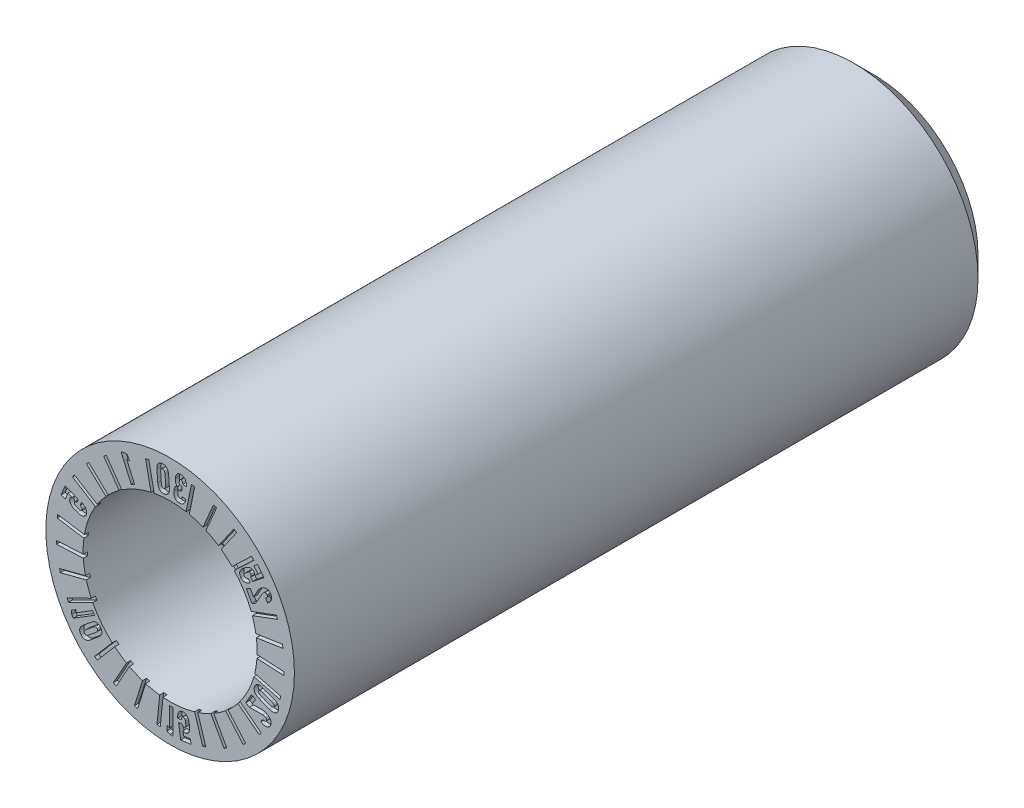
SolidWorks part; units mm, degrees
ref_plane "Front Plane" through (0, 0, 0) normal (0, 0, 1) x (1, 0, 0)
ref_plane "Top Plane" through (0, 0, 0) normal (0, 1, 0) x (1, 0, 0)
ref_plane "Right Plane" through (0, 0, 0) normal (1, 0, 0) x (0, 0, -1)
sketch "Sketch1" plane through (0, 0, 0) normal (1, 0, 0) x (0, 0, -1)
  line L0 (0, 0) -> (18.1572, 0) construction
  line L2 (17, 1.5) -> (17, 2.5)
  line L4 (16.5, 3) -> (0, 3)
  line L5 (0, 3) -> (0, 2.1)
  line L7 (0, 2.1) -> (3, 2.1)
  line L8 (3, 2.1) -> (3, 0.8)
  line L9 (3, 0.8) -> (12, 0.8)
  line L10 (17, 1.5) -> (12, 1.5)
  line L11 (12, 0.8) -> (12, 1.5)
  line L12 (17, 2.5) -> (16.5, 3)
  point P6 (17, 3)
  dimension "D1" = 17
  dimension "D2" = 6
  dimension "D3" = 4.2
  dimension "D4" = 3
  dimension "D5" = 1.6
  dimension "D6" = 3
  dimension "D7" = 5
revolve "Revolve1" add sketch "Sketch1" angle 360 about L0
sketch "Sketch2" plane through (0, 0, 0) normal (0, 0, 1) x (1, 0, 0)
  line L0 (0, 0) -> (0, 3.2841) construction
  line L1 (0, 0) -> (0.6611, 3.2169) construction
  line L2 (0, 0) -> (1.2951, 3.018) construction
  line L3 (0, 0) -> (1.8761, 2.6955) construction
  line L4 (0, 0) -> (2.3803, 2.2626) construction
  line L5 (0, 0) -> (2.787, 1.7372) construction
  line L6 (0, 0) -> (3.0797, 1.1406) construction
  line L7 (0, 0) -> (3.2462, 0.4973) construction
  line L8 (0, 0) -> (3.2799, -0.1663) construction
  line L9 (0, 0) -> (3.1793, -0.8232) construction
  line L10 (0, 0) -> (2.9485, -1.4463) construction
  line L11 (0, 0) -> (2.597, -2.0102) construction
  line L12 (0, 0) -> (2.1392, -2.4918) construction
  line L13 (0, 0) -> (1.5938, -2.8715) construction
  line L14 (0, 0) -> (0.9831, -3.1335) construction
  line L15 (0, 0) -> (0.3322, -3.2673) construction
  line L16 (0, 0) -> (-0.3322, -3.2673) construction
  line L17 (0, 0) -> (-0.9831, -3.1335) construction
  line L18 (0, 0) -> (-1.5938, -2.8715) construction
  line L19 (0, 0) -> (-2.1392, -2.4918) construction
  line L20 (0, 0) -> (-2.597, -2.0102) construction
  line L21 (0, 0) -> (-2.9485, -1.4463) construction
  line L22 (0, 0) -> (-3.1793, -0.8232) construction
  line L23 (0, 0) -> (-3.2799, -0.1663) construction
  line L24 (0, 0) -> (-3.2462, 0.4973) construction
  line L25 (0, 0) -> (-3.0797, 1.1406) construction
  line L26 (0, 0) -> (-2.787, 1.7372) construction
  line L27 (0, 0) -> (-2.3803, 2.2626) construction
  line L28 (0, 0) -> (-1.8761, 2.6955) construction
  line L29 (0, 0) -> (-1.2951, 3.018) construction
  line L30 (0, 0) -> (-0.6611, 3.2169) construction
  line L31 (0.5928, 2.6857) -> (0.4418, 1.951)
  line L32 (2.0637, 0.9899) -> (2.2207, 1.2619)
  line L33 (2.2731, 1.3172) -> (2.2736, 1.3176)
  line L34 (2.3047, 1.2213) -> (2.3044, 1.221)
  line L35 (2.3044, 1.221) -> (2.3485, 1.1416)
  line L36 (0.5144, 2.7018) -> (0.5928, 2.6857)
  line L37 (0.5144, 2.7018) -> (0.3634, 1.9671)
  line L38 (0.3634, 1.9671) -> (0.4418, 1.951)
  line L39 (1.1212, 2.5114) -> (0.8255, 1.8221)
  line L40 (1.0477, 2.5429) -> (1.1212, 2.5114)
  line L41 (1.0477, 2.5429) -> (0.752, 1.8537)
  line L42 (0.752, 1.8537) -> (0.8255, 1.8221)
  line L43 (1.6038, 2.2342) -> (1.1754, 1.6187)
  line L44 (1.5382, 2.28) -> (1.6038, 2.2342)
  line L45 (1.5382, 2.28) -> (1.1097, 1.6644)
  line L46 (1.1097, 1.6644) -> (1.1754, 1.6187)
  line L47 (2.0207, 1.8657) -> (1.4771, 1.3489)
  line L48 (1.9656, 1.9237) -> (2.0207, 1.8657)
  line L49 (1.9656, 1.9237) -> (1.422, 1.4069)
  line L50 (1.422, 1.4069) -> (1.4771, 1.3489)
  line L51 (2.3485, 1.1416) -> (2.3488, 1.1418)
  line L52 (2.2323, 1.3989) -> (2.2319, 1.3987)
  line L53 (2.1187, 1.2871) -> (2.0128, 1.0958)
  line L54 (2.0128, 1.0958) -> (1.9347, 1.2364)
  line L55 (2.5927, 0.9176) -> (1.8894, 0.6571)
  line L56 (2.5649, 0.9926) -> (2.5927, 0.9176)
  line L57 (2.5649, 0.9926) -> (1.8616, 0.7321)
  line L58 (1.8616, 0.7321) -> (1.8894, 0.6571)
  line L59 (2.7243, 0.3769) -> (1.983, 0.2633)
  line L60 (2.7122, 0.456) -> (2.7243, 0.3769)
  line L61 (2.7122, 0.456) -> (1.9709, 0.3424)
  line L62 (1.9709, 0.3424) -> (1.983, 0.2633)
  line L63 (2.7444, -0.1792) -> (1.9954, -0.1412)
  line L64 (2.7485, -0.0993) -> (2.7444, -0.1792)
  line L65 (2.7485, -0.0993) -> (1.9995, -0.0613)
  line L66 (1.9995, -0.0613) -> (1.9954, -0.1412)
  line L67 (2.6522, -0.728) -> (1.9261, -0.54)
  line L68 (2.6722, -0.6506) -> (2.6522, -0.728)
  line L69 (2.6722, -0.6506) -> (1.9462, -0.4626)
  line L70 (1.9462, -0.4626) -> (1.9261, -0.54)
  line L71 (1.9347, 1.2364) -> (1.8399, 1.1836)
  line L72 (1.8399, 1.1836) -> (1.975, 0.9406)
  line L73 (1.975, 0.9406) -> (2.0637, 0.9899)
  line L74 (1.9354, 1.3515) -> (1.9357, 1.3517)
  line L75 (2.1501, -1.7149) -> (1.5571, -1.2558)
  line L76 (2.1991, -1.6517) -> (2.1501, -1.7149)
  line L77 (2.1991, -1.6517) -> (1.606, -1.1926)
  line L78 (1.606, -1.1926) -> (1.5571, -1.2558)
  line L79 (1.606, -1.1926) -> (1.5571, -1.2558)
  line L80 (1.7609, -2.1126) -> (1.2724, -1.5436)
  line L81 (1.8216, -2.0605) -> (1.7609, -2.1126)
  line L82 (1.3331, -1.4915) -> (1.2724, -1.5436)
  line L83 (1.8216, -2.0605) -> (1.3331, -1.4915)
  line L84 (1.3331, -1.4915) -> (1.2724, -1.5436)
  line L85 (1.2996, -2.4239) -> (0.9356, -1.7681)
  line L86 (1.3696, -2.385) -> (1.2996, -2.4239)
  line L87 (1.3696, -2.385) -> (1.0056, -1.7293)
  line L88 (1.0056, -1.7293) -> (0.9356, -1.7681)
  line L89 (0.7851, -2.6359) -> (0.5606, -1.9203)
  line L90 (0.8614, -2.6119) -> (0.7851, -2.6359)
  line L91 (0.8614, -2.6119) -> (0.6369, -1.8963)
  line L92 (0.6369, -1.8963) -> (0.5606, -1.9203)
  line L93 (1.9357, 1.3517) -> (1.8803, 1.4219)
  line L94 (1.8803, 1.4219) -> (1.88, 1.4217)
  line L95 (1.8216, 1.5033) -> (1.8613, 1.5345)
  line L96 (1.9417, 1.476) -> (1.9934, 1.4104)
  line L97 (-0.318, -2.7318) -> (-0.2421, -1.9857)
  line L98 (-0.2384, -2.7399) -> (-0.318, -2.7318)
  line L99 (-0.2384, -2.7399) -> (-0.1625, -1.9938)
  line L100 (-0.1625, -1.9938) -> (-0.2421, -1.9857)
  line L101 (-0.8614, -2.6119) -> (-0.6369, -1.8963)
  line L102 (-0.7851, -2.6359) -> (-0.8614, -2.6119)
  line L103 (-0.7851, -2.6359) -> (-0.5606, -1.9203)
  line L104 (-0.5606, -1.9203) -> (-0.6369, -1.8963)
  line L105 (-1.3696, -2.385) -> (-1.0056, -1.7293)
  line L106 (-1.2996, -2.4239) -> (-1.3696, -2.385)
  line L107 (-1.2996, -2.4239) -> (-0.9356, -1.7681)
  line L108 (-0.9356, -1.7681) -> (-1.0056, -1.7293)
  line L109 (-1.8216, -2.0605) -> (-1.3331, -1.4915)
  line L110 (-1.7609, -2.1126) -> (-1.8216, -2.0605)
  line L111 (-1.7609, -2.1126) -> (-1.2724, -1.5436)
  line L112 (-1.2724, -1.5436) -> (-1.3331, -1.4915)
  line L113 (1.9934, 1.4104) -> (2.2651, 1.6243)
  line L114 (2.2651, 1.6243) -> (2.1076, 1.8245)
  line L115 (2.1076, 1.8245) -> (2.0217, 1.7569)
  line L116 (2.0217, 1.7569) -> (2.1239, 1.627)
  line L117 (-2.4866, -1.1752) -> (-1.8132, -0.8449)
  line L118 (-2.4513, -1.247) -> (-2.4866, -1.1752)
  line L119 (-2.4513, -1.247) -> (-1.778, -0.9167)
  line L120 (-1.778, -0.9167) -> (-1.8132, -0.8449)
  line L121 (-2.6722, -0.6506) -> (-1.9462, -0.4626)
  line L122 (-2.6522, -0.728) -> (-2.6722, -0.6506)
  line L123 (-2.6522, -0.728) -> (-1.9261, -0.54)
  line L124 (-1.9261, -0.54) -> (-1.9462, -0.4626)
  line L125 (-2.7485, -0.0993) -> (-1.9995, -0.0613)
  line L126 (-2.7444, -0.1792) -> (-2.7485, -0.0993)
  line L127 (-2.7444, -0.1792) -> (-1.9954, -0.1412)
  line L128 (-1.9954, -0.1412) -> (-1.9995, -0.0613)
  line L129 (-2.7122, 0.456) -> (-1.9709, 0.3424)
  line L130 (-2.7243, 0.3769) -> (-2.7122, 0.456)
  line L131 (-2.7243, 0.3769) -> (-1.983, 0.2633)
  line L132 (-1.983, 0.2633) -> (-1.9709, 0.3424)
  line L133 (2.1239, 1.627) -> (2.0404, 1.5612)
  line L134 (1.8061, 1.6047) -> (1.7664, 1.5735)
  line L135 (0.38, 2.3195) -> (0.288, 2.3286)
  line L136 (0.1865, 2.3488) -> (0.1878, 2.3629)
  line L137 (-2.3126, 1.4886) -> (-1.6761, 1.0919)
  line L138 (-2.3549, 1.4207) -> (-2.3126, 1.4886)
  line L139 (-2.3549, 1.4207) -> (-1.7184, 1.024)
  line L140 (-1.7184, 1.024) -> (-1.6761, 1.0919)
  line L141 (-1.9656, 1.9237) -> (-1.422, 1.4069)
  line L142 (-2.0207, 1.8657) -> (-1.9656, 1.9237)
  line L143 (-2.0207, 1.8657) -> (-1.4771, 1.3489)
  line L144 (-1.4771, 1.3489) -> (-1.422, 1.4069)
  line L145 (-1.5382, 2.28) -> (-1.1097, 1.6644)
  line L146 (-1.6038, 2.2342) -> (-1.5382, 2.28)
  line L147 (-1.6038, 2.2342) -> (-1.1754, 1.6187)
  line L148 (-1.1754, 1.6187) -> (-1.1097, 1.6644)
  line L149 (0.2379, 2.4301) -> (0.2779, 2.4262)
  line L150 (0.2779, 2.4262) -> (0.2886, 2.5351)
  line L151 (0.2886, 2.5351) -> (0.2486, 2.539)
  line L152 (0.2193, 2.6043) -> (0.2204, 2.6147)
  line L153 (-0.5144, 2.7018) -> (-0.3634, 1.9671)
  line L154 (-0.5928, 2.6857) -> (-0.5144, 2.7018)
  line L155 (-0.5928, 2.6857) -> (-0.4418, 1.951)
  line L156 (-0.4418, 1.951) -> (-0.3634, 1.9671)
  line L157 (0.3068, 2.5975) -> (0.3984, 2.5885)
  line L158 (0.126, 2.6355) -> (0.1242, 2.6175)
  line L159 (0.0914, 2.3636) -> (0.0897, 2.3455)
  line L160 (-0.0175, 2.3512) -> (-0.0357, 2.624)
  line L161 (-0.3183, 2.6051) -> (-0.3001, 2.3322)
  line L162 (-0.213, 2.3672) -> (-0.2273, 2.5822)
  line L163 (-0.1228, 2.5891) -> (-0.1084, 2.3741)
  line L164 (-0.9396, 1.9762) -> (-0.8578, 2.0123)
  line L165 (-0.8578, 2.0123) -> (-1.047, 2.4408)
  line L166 (-1.047, 2.4408) -> (-0.9831, 2.4387)
  line L167 (-0.9831, 2.4387) -> (-1.0317, 2.5488)
  line L168 (-1.0317, 2.5488) -> (-1.1128, 2.5573)
  line L169 (-1.1128, 2.5573) -> (-1.1826, 2.5265)
  line L170 (-1.1826, 2.5265) -> (-0.9396, 1.9762)
  line L171 (-2.1374, 0.9993) -> (-2.1377, 0.9995)
  line L172 (-2.1377, 0.9995) -> (-2.1707, 0.9168)
  line L173 (-2.1707, 0.9168) -> (-2.1703, 0.9167)
  line L174 (-2.2114, 0.8258) -> (-2.258, 0.8443)
  line L175 (-2.2476, 0.9425) -> (-2.2168, 1.0198)
  line L176 (-2.2168, 1.0198) -> (-2.5362, 1.1472)
  line L177 (-2.5362, 1.1472) -> (-2.6302, 0.9115)
  line L178 (-2.6302, 0.9115) -> (-2.5294, 0.8713)
  line L179 (-2.5294, 0.8713) -> (-2.4684, 1.0243)
  line L180 (-2.4684, 1.0243) -> (-2.3702, 0.9852)
  line L181 (-2.291, 0.7615) -> (-2.2444, 0.743)
  line L182 (-1.8262, -1.2053) -> (-1.873, -1.13)
  line L183 (-1.873, -1.13) -> (-2.2712, -1.3774)
  line L184 (-2.2712, -1.3774) -> (-2.2778, -1.314)
  line L185 (-2.2778, -1.314) -> (-2.3802, -1.3777)
  line L186 (-2.3802, -1.3777) -> (-2.3775, -1.4587)
  line L187 (-2.3775, -1.4587) -> (-2.3375, -1.523)
  line L188 (-2.3375, -1.523) -> (-1.8262, -1.2053)
  line L189 (-1.8988, -1.3848) -> (-2.1081, -1.558)
  line L190 (-1.9297, -1.7737) -> (-1.7203, -1.6005)
  line L191 (-1.7987, -1.551) -> (-1.9636, -1.6875)
  line L192 (-2.0297, -1.6076) -> (-1.8648, -1.4712)
  line L193 (0.0698, -2.1869) -> (-0.0193, -2.1873)
  line L194 (-0.0193, -2.1873) -> (-0.0168, -2.6545)
  line L195 (-0.0168, -2.6545) -> (-0.0745, -2.6271)
  line L196 (-0.0745, -2.6271) -> (-0.0738, -2.7473)
  line L197 (-0.0738, -2.7473) -> (-0.0032, -2.7873)
  line L198 (-0.0032, -2.7873) -> (0.0729, -2.7869)
  line L199 (0.0729, -2.7869) -> (0.0698, -2.1869)
  line L200 (0.1841, -2.3527) -> (0.1841, -2.3532)
  line L201 (0.1841, -2.3532) -> (0.2721, -2.3409)
  line L202 (0.2721, -2.3409) -> (0.2721, -2.3404)
  line L203 (0.3712, -2.3314) -> (0.3781, -2.3813)
  line L204 (0.2877, -2.4208) -> (0.2055, -2.4321)
  line L205 (0.2055, -2.4321) -> (0.2528, -2.774)
  line L206 (0.2528, -2.774) -> (0.5034, -2.7393)
  line L207 (0.5034, -2.7393) -> (0.4885, -2.6314)
  line L208 (0.4885, -2.6314) -> (0.3259, -2.6539)
  line L209 (0.3259, -2.6539) -> (0.3114, -2.5489)
  line L210 (0.4661, -2.3692) -> (0.4592, -2.3193)
  line L211 (1.9118, -1.26) -> (2.2277, -1.2565)
  line L212 (2.3024, -1.2734) -> (2.303, -1.2738)
  line L213 (2.2356, -1.3501) -> (2.2352, -1.3499)
  line L214 (2.2352, -1.3499) -> (2.1891, -1.4288)
  line L215 (2.1891, -1.4288) -> (2.1895, -1.429)
  line L216 (2.3522, -1.1963) -> (2.3519, -1.1961)
  line L217 (2.1972, -1.1552) -> (1.9773, -1.1617)
  line L218 (1.9773, -1.1617) -> (2.0589, -1.022)
  line L219 (2.0589, -1.022) -> (1.9646, -0.967)
  line L220 (1.9646, -0.967) -> (1.8236, -1.2086)
  line L221 (1.8236, -1.2086) -> (1.9118, -1.26)
  line L222 (2.1458, -0.9596) -> (2.4, -1.0566)
  line L223 (2.5011, -0.7914) -> (2.2468, -0.6944)
  line L224 (2.2419, -0.7882) -> (2.4425, -0.8646)
  line L225 (2.4051, -0.9627) -> (2.2045, -0.8863)
  circle A0 centre (0, 0) radius 2.19 construction
  spline S0 degree 3 poles (2.2207, 1.2619) (2.2276, 1.2736) (2.2426, 1.2947) (2.2624, 1.3114) (2.2731, 1.3172) knots 0 0 0 0 0.529779 1 1 1 1
  spline S1 degree 3 poles (2.2736, 1.3176) (2.2799, 1.3211) (2.2898, 1.3253) (2.3033, 1.3264) (2.3124, 1.3253) (2.321, 1.3223) (2.3316, 1.3148) (2.3377, 1.3069) (2.3409, 1.3009) knots 0 0 0 0 0.277882 0.397737 0.512348 0.625009 0.741539 1 1 1 1
  spline S2 degree 3 poles (2.3409, 1.3009) (2.344, 1.2949) (2.3474, 1.2848) (2.3459, 1.2709) (2.3422, 1.2605) (2.3363, 1.2501) (2.3246, 1.2358) (2.313, 1.227) (2.3047, 1.2213) knots 0 0 0 0 0.211859 0.317642 0.429326 0.552126 0.685954 1 1 1 1
  spline S3 degree 3 poles (2.3488, 1.1418) (2.3637, 1.1511) (2.3844, 1.1661) (2.4082, 1.1891) (2.4227, 1.2065) (2.4345, 1.2244) (2.4434, 1.2427) (2.4497, 1.2612) (2.4528, 1.2799) (2.453, 1.2986) (2.4495, 1.3238) (2.442, 1.3417) (2.4359, 1.3531) knots 0 0 0 0 0.20617 0.30012 0.388776 0.472799 0.551941 0.627966 0.701776 0.774795 0.847377 1 1 1 1
  spline S4 degree 3 poles (2.4359, 1.3531) (2.4292, 1.365) (2.4179, 1.3817) (2.3987, 1.3995) (2.3837, 1.4102) (2.3675, 1.418) (2.3504, 1.4235) (2.3323, 1.4259) (2.3134, 1.4259) (2.2938, 1.4232) (2.266, 1.4156) (2.2456, 1.4064) (2.2323, 1.3989) knots 0 0 0 0 0.173121 0.25308 0.330087 0.40532 0.479923 0.556638 0.635687 0.71888 0.806511 1 1 1 1
  spline S5 degree 3 poles (2.2319, 1.3987) (2.2201, 1.3921) (2.203, 1.3809) (2.1818, 1.3638) (2.1667, 1.3498) (2.1526, 1.3351) (2.136, 1.3146) (2.1248, 1.2985) (2.1187, 1.2871) knots 0 0 0 0 0.252437 0.379585 0.5081 0.63539 0.759541 1 1 1 1
  spline S6 degree 3 poles (1.7078, 1.3492) (1.7153, 1.3395) (1.7288, 1.3269) (1.75, 1.3146) (1.7671, 1.308) (1.7855, 1.304) (1.805, 1.3026) (1.8254, 1.3042) (1.8467, 1.3082) (1.8686, 1.3149) (1.8991, 1.3281) (1.9211, 1.3413) (1.9354, 1.3515) knots 0 0 0 0 0.145565 0.216803 0.289118 0.363216 0.439795 0.520502 0.6059 0.696418 0.791616 1 1 1 1
  spline S7 degree 3 poles (1.88, 1.4217) (1.8717, 1.4163) (1.8592, 1.409) (1.8417, 1.4038) (1.83, 1.402) (1.8191, 1.4026) (1.8059, 1.4066) (1.7977, 1.413) (1.7936, 1.4184) knots 0 0 0 0 0.313122 0.447855 0.571402 0.684353 0.788182 1 1 1 1
  spline S8 degree 3 poles (1.7936, 1.4184) (1.7891, 1.424) (1.7842, 1.434) (1.7837, 1.4484) (1.7861, 1.4595) (1.7912, 1.4707) (1.8021, 1.4864) (1.8133, 1.4967) (1.8216, 1.5033) knots 0 0 0 0 0.215103 0.317748 0.42874 0.549005 0.683265 1 1 1 1
  spline S9 degree 3 poles (1.8613, 1.5345) (1.8696, 1.5409) (1.882, 1.5495) (1.8995, 1.5568) (1.9111, 1.5595) (1.9218, 1.5599) (1.9348, 1.5568) (1.9428, 1.5507) (1.9467, 1.5456) knots 0 0 0 0 0.328896 0.466594 0.588365 0.698844 0.799357 1 1 1 1
  spline S10 degree 3 poles (1.9467, 1.5456) (1.9505, 1.5408) (1.9549, 1.5328) (1.9575, 1.5211) (1.9575, 1.5121) (1.9562, 1.5029) (1.9515, 1.4903) (1.9462, 1.4815) (1.9417, 1.476) knots 0 0 0 0 0.239591 0.354231 0.472311 0.593605 0.720008 1 1 1 1
  spline S11 degree 3 poles (2.0404, 1.5612) (2.0414, 1.5665) (2.0423, 1.5749) (2.041, 1.5863) (2.0389, 1.5951) (2.0361, 1.6038) (2.0313, 1.6147) (2.0266, 1.6222) (2.023, 1.6268) knots 0 0 0 0 0.23392 0.358399 0.489029 0.62252 0.749853 1 1 1 1
  spline S12 degree 3 poles (2.023, 1.6268) (2.0159, 1.6359) (2.0033, 1.6478) (1.9832, 1.6586) (1.967, 1.6635) (1.9498, 1.6658) (1.9315, 1.6653) (1.9124, 1.6618) (1.8922, 1.6557) (1.8714, 1.6469) (1.8417, 1.631) (1.8203, 1.6158) (1.8061, 1.6047) knots 0 0 0 0 0.141547 0.209725 0.277898 0.348273 0.421797 0.501332 0.586949 0.679288 0.778148 1 1 1 1
  spline S13 degree 3 poles (1.7664, 1.5735) (1.7523, 1.5622) (1.7325, 1.5447) (1.7108, 1.5186) (1.6981, 1.4994) (1.6883, 1.4802) (1.6817, 1.4608) (1.678, 1.4415) (1.6775, 1.4222) (1.6804, 1.4031) (1.6885, 1.3776) (1.6993, 1.3601) (1.7078, 1.3492) knots 0 0 0 0 0.207302 0.300824 0.388239 0.470212 0.547547 0.621857 0.694916 0.767378 0.841505 1 1 1 1
  spline S14 degree 3 poles (0.2121, 2.1664) (0.2258, 2.1651) (0.2462, 2.1654) (0.2724, 2.1714) (0.2906, 2.1782) (0.3077, 2.1878) (0.3232, 2.1999) (0.3373, 2.2144) (0.3499, 2.2312) (0.3606, 2.2504) (0.3726, 2.2795) (0.3778, 2.3032) (0.38, 2.3195) knots 0 0 0 0 0.161942 0.23881 0.315286 0.391715 0.468408 0.54725 0.629428 0.715517 0.805318 1 1 1 1
  spline S15 degree 3 poles (0.288, 2.3286) (0.2856, 2.3179) (0.2808, 2.3026) (0.2682, 2.2871) (0.2594, 2.2804) (0.2517, 2.2769) (0.2434, 2.2751) (0.237, 2.2745) (0.2327, 2.2752) knots 0 0 0 0 0.388971 0.550762 0.700692 0.774228 0.847083 1 1 1 1
  spline S16 degree 3 poles (0.2327, 2.2752) (0.2251, 2.276) (0.2138, 2.279) (0.2018, 2.2881) (0.1949, 2.297) (0.1897, 2.3076) (0.1856, 2.3251) (0.1854, 2.3391) (0.1865, 2.3488) knots 0 0 0 0 0.235089 0.344659 0.455814 0.574713 0.702666 1 1 1 1
  spline S17 degree 3 poles (0.1878, 2.3629) (0.1889, 2.373) (0.1912, 2.3874) (0.1978, 2.4046) (0.2037, 2.4145) (0.2107, 2.4222) (0.2215, 2.4297) (0.2316, 2.4307) (0.2379, 2.4301) knots 0 0 0 0 0.326553 0.463178 0.585324 0.694283 0.794827 1 1 1 1
  spline S18 degree 3 poles (0.2486, 2.539) (0.2434, 2.5394) (0.2356, 2.5423) (0.2281, 2.5503) (0.2237, 2.5581) (0.2207, 2.5675) (0.2178, 2.583) (0.2188, 2.5956) (0.2193, 2.6043) knots 0 0 0 0 0.198535 0.297802 0.407745 0.531561 0.670162 1 1 1 1
  spline S19 degree 3 poles (0.2204, 2.6147) (0.2213, 2.6228) (0.2231, 2.6346) (0.2291, 2.6484) (0.2344, 2.6563) (0.2406, 2.6626) (0.2505, 2.6683) (0.2592, 2.6692) (0.2648, 2.6686) knots 0 0 0 0 0.31486 0.448896 0.568857 0.678511 0.783343 1 1 1 1
  spline S20 degree 3 poles (0.2648, 2.6686) (0.2687, 2.6681) (0.2746, 2.6668) (0.2815, 2.6626) (0.2864, 2.6587) (0.2906, 2.6538) (0.2946, 2.6481) (0.2978, 2.6415) (0.3008, 2.6342) (0.3032, 2.6261) (0.3055, 2.6138) (0.3067, 2.6042) (0.3068, 2.5975) knots 0 0 0 0 0.131182 0.197377 0.266693 0.338458 0.414388 0.495687 0.583148 0.676772 0.776722 1 1 1 1
  spline S21 degree 3 poles (0.3984, 2.5885) (0.3988, 2.6058) (0.3978, 2.6313) (0.3915, 2.6635) (0.3849, 2.6853) (0.3763, 2.705) (0.3661, 2.7228) (0.354, 2.7382) (0.3403, 2.7513) (0.325, 2.762) (0.303, 2.7732) (0.2848, 2.7775) (0.2724, 2.7787) knots 0 0 0 0 0.205912 0.300585 0.390039 0.475318 0.555933 0.632498 0.707172 0.780861 0.852752 1 1 1 1
  spline S22 degree 3 poles (0.2724, 2.7787) (0.2625, 2.7797) (0.2479, 2.7799) (0.229, 2.7775) (0.2159, 2.7742) (0.2036, 2.7696) (0.192, 2.7637) (0.1812, 2.7563) (0.1712, 2.7476) (0.1622, 2.7376) (0.154, 2.7266) (0.1469, 2.7142) (0.1408, 2.7007) (0.1355, 2.6861) (0.1299, 2.6644) (0.1271, 2.6473) (0.126, 2.6355) knots 0 0 0 0 0.12842 0.187774 0.245867 0.302043 0.357057 0.413194 0.469772 0.527569 0.586362 0.647548 0.710798 0.777271 0.847356 1 1 1 1
  spline S23 degree 3 poles (0.1242, 2.6175) (0.1228, 2.6043) (0.1229, 2.5849) (0.1276, 2.5601) (0.1333, 2.5432) (0.141, 2.5278) (0.1538, 2.5094) (0.1667, 2.4983) (0.1761, 2.4924) knots 0 0 0 0 0.276788 0.405134 0.529423 0.649684 0.765986 1 1 1 1
  spline S24 degree 3 poles (0.1761, 2.4924) (0.1704, 2.4913) (0.162, 2.4889) (0.1515, 2.4838) (0.1442, 2.4792) (0.1372, 2.4736) (0.1306, 2.4673) (0.1245, 2.4601) (0.1168, 2.4492) (0.1082, 2.4338) (0.0973, 2.4044) (0.0931, 2.3803) (0.0914, 2.3636) knots 0 0 0 0 0.105235 0.157994 0.209744 0.263201 0.318348 0.375263 0.434459 0.559474 0.694436 1 1 1 1
  spline S25 degree 3 poles (0.0897, 2.3455) (0.0882, 2.3292) (0.0874, 2.3054) (0.0916, 2.2749) (0.0966, 2.2545) (0.104, 2.2361) (0.1135, 2.2196) (0.1251, 2.2051) (0.1389, 2.1927) (0.1546, 2.1826) (0.1786, 2.1717) (0.1985, 2.1679) (0.2121, 2.1664) knots 0 0 0 0 0.199145 0.289506 0.374196 0.454277 0.530709 0.60547 0.680126 0.755056 0.832679 1 1 1 1
  spline S26 degree 3 poles (-0.1474, 2.1713) (-0.1365, 2.1719) (-0.1207, 2.1744) (-0.1007, 2.1804) (-0.0873, 2.1863) (-0.075, 2.1936) (-0.0637, 2.2021) (-0.0538, 2.2122) (-0.0449, 2.2235) (-0.0372, 2.2359) (-0.0308, 2.2494) (-0.0255, 2.2639) (-0.0215, 2.2795) (-0.0185, 2.296) (-0.0165, 2.32) (-0.0166, 2.3385) (-0.0175, 2.3512) knots 0 0 0 0 0.13016 0.19012 0.24768 0.303978 0.359804 0.415487 0.472083 0.529959 0.589147 0.649889 0.713387 0.779647 0.849298 1 1 1 1
  spline S27 degree 3 poles (-0.0357, 2.624) (-0.0367, 2.6368) (-0.0386, 2.6554) (-0.0443, 2.6791) (-0.0493, 2.6952) (-0.0553, 2.71) (-0.0625, 2.7237) (-0.0708, 2.7361) (-0.08, 2.7474) (-0.0904, 2.7572) (-0.1016, 2.7657) (-0.1138, 2.7728) (-0.1271, 2.7781) (-0.1411, 2.7822) (-0.1616, 2.7856) (-0.1776, 2.7858) (-0.1885, 2.785) knots 0 0 0 0 0.152277 0.222409 0.288792 0.352398 0.413277 0.472029 0.529731 0.586282 0.641468 0.697121 0.753158 0.810891 0.870837 1 1 1 1
  spline S28 degree 3 poles (-0.1885, 2.785) (-0.1994, 2.7845) (-0.2152, 2.7819) (-0.2352, 2.776) (-0.2486, 2.77) (-0.2609, 2.7629) (-0.2721, 2.7545) (-0.282, 2.7445) (-0.2909, 2.7334) (-0.2986, 2.7211) (-0.3051, 2.7076) (-0.3103, 2.6931) (-0.3143, 2.6776) (-0.3174, 2.661) (-0.3193, 2.6366) (-0.3191, 2.6179) (-0.3183, 2.6051) knots 0 0 0 0 0.13002 0.189916 0.247414 0.303466 0.358571 0.4139 0.4701 0.527541 0.586261 0.646938 0.710368 0.777017 0.847539 1 1 1 1
  spline S29 degree 3 poles (-0.3001, 2.3322) (-0.2994, 2.3195) (-0.2969, 2.3009) (-0.2916, 2.2773) (-0.2867, 2.2612) (-0.2804, 2.2463) (-0.2733, 2.2326) (-0.265, 2.2201) (-0.2557, 2.2089) (-0.2455, 2.1989) (-0.2341, 2.1906) (-0.222, 2.1834) (-0.2088, 2.1781) (-0.1948, 2.174) (-0.1742, 2.1709) (-0.1583, 2.1705) (-0.1474, 2.1713) knots 0 0 0 0 0.151887 0.222003 0.288414 0.352171 0.413076 0.472289 0.530016 0.586288 0.641844 0.697136 0.753197 0.810955 0.870782 1 1 1 1
  spline S30 degree 3 poles (-0.1548, 2.2802) (-0.1629, 2.2796) (-0.1753, 2.2815) (-0.1887, 2.291) (-0.1965, 2.3012) (-0.2028, 2.314) (-0.2099, 2.336) (-0.212, 2.3543) (-0.213, 2.3672) knots 0 0 0 0 0.207493 0.305394 0.412258 0.53234 0.668837 1 1 1 1
  spline S31 degree 3 poles (-0.2273, 2.5822) (-0.2281, 2.5951) (-0.2284, 2.6136) (-0.2245, 2.6363) (-0.2197, 2.6498) (-0.2134, 2.661) (-0.2012, 2.672) (-0.1893, 2.6757) (-0.1812, 2.6761) knots 0 0 0 0 0.330842 0.467787 0.587447 0.694097 0.792854 1 1 1 1
  spline S32 degree 3 poles (-0.1812, 2.6761) (-0.1731, 2.6767) (-0.1607, 2.6748) (-0.1472, 2.6653) (-0.1392, 2.6551) (-0.1329, 2.6423) (-0.1261, 2.6203) (-0.1236, 2.6021) (-0.1228, 2.5891) knots 0 0 0 0 0.207314 0.306599 0.41391 0.533888 0.669057 1 1 1 1
  spline S33 degree 3 poles (-0.1084, 2.3741) (-0.1075, 2.3612) (-0.1075, 2.3428) (-0.1115, 2.3201) (-0.1159, 2.3064) (-0.1226, 2.2954) (-0.1345, 2.284) (-0.1468, 2.2808) (-0.1548, 2.2802) knots 0 0 0 0 0.330464 0.467167 0.587067 0.693376 0.792554 1 1 1 1
  spline S34 degree 3 poles (-2.0224, 0.8045) (-2.0178, 0.8158) (-2.0135, 0.8337) (-2.0134, 0.8581) (-2.0163, 0.8762) (-2.0219, 0.8941) (-2.0305, 0.9114) (-2.0418, 0.9284) (-2.0559, 0.9447) (-2.0726, 0.9601) (-2.0992, 0.9797) (-2.1215, 0.9921) (-2.1374, 0.9993) knots 0 0 0 0 0.145465 0.217097 0.289642 0.363738 0.440147 0.52057 0.606215 0.696771 0.791878 1 1 1 1
  spline S35 degree 3 poles (-2.1703, 0.9167) (-2.1614, 0.9123) (-2.1492, 0.9049) (-2.1358, 0.8927) (-2.1285, 0.8834) (-2.1235, 0.8737) (-2.1203, 0.8603) (-2.122, 0.85) (-2.1245, 0.8438) knots 0 0 0 0 0.312566 0.447532 0.569881 0.683318 0.788126 1 1 1 1
  spline S36 degree 3 poles (-2.1245, 0.8438) (-2.1271, 0.8372) (-2.1331, 0.8279) (-2.1454, 0.8203) (-2.1561, 0.817) (-2.1683, 0.8158) (-2.1873, 0.8172) (-2.2016, 0.8221) (-2.2114, 0.8258) knots 0 0 0 0 0.214907 0.318694 0.428977 0.549867 0.683154 1 1 1 1
  spline S37 degree 3 poles (-2.258, 0.8443) (-2.2677, 0.8483) (-2.2814, 0.8545) (-2.2962, 0.8661) (-2.3045, 0.8746) (-2.31, 0.8838) (-2.3142, 0.8964) (-2.3126, 0.9063) (-2.3102, 0.9123) knots 0 0 0 0 0.329808 0.465965 0.588972 0.699114 0.79873 1 1 1 1
  spline S38 degree 3 poles (-2.3102, 0.9123) (-2.308, 0.9179) (-2.3032, 0.9256) (-2.2945, 0.9338) (-2.2866, 0.9383) (-2.278, 0.9416) (-2.2649, 0.9441) (-2.2545, 0.9437) (-2.2476, 0.9425) knots 0 0 0 0 0.238624 0.355233 0.472857 0.594977 0.720064 1 1 1 1
  spline S39 degree 3 poles (-2.3702, 0.9852) (-2.3753, 0.9834) (-2.3828, 0.9798) (-2.392, 0.9731) (-2.3986, 0.9669) (-2.4048, 0.9602) (-2.4115, 0.9504) (-2.416, 0.9429) (-2.418, 0.9374) knots 0 0 0 0 0.233329 0.358376 0.488644 0.622174 0.749846 1 1 1 1
  spline S40 degree 3 poles (-2.418, 0.9374) (-2.4221, 0.9266) (-2.4265, 0.9098) (-2.4254, 0.8872) (-2.4218, 0.8708) (-2.415, 0.8549) (-2.4057, 0.8393) (-2.393, 0.8246) (-2.3779, 0.8103) (-2.3599, 0.7968) (-2.3315, 0.779) (-2.3076, 0.7682) (-2.291, 0.7615) knots 0 0 0 0 0.142472 0.209678 0.277734 0.348186 0.422229 0.501188 0.586666 0.678728 0.778225 1 1 1 1
  spline S41 degree 3 poles (-2.2444, 0.743) (-2.2277, 0.7362) (-2.2028, 0.7282) (-2.1695, 0.7225) (-2.1467, 0.7211) (-2.1253, 0.7225) (-2.1052, 0.7262) (-2.0868, 0.7329) (-2.07, 0.7421) (-2.055, 0.754) (-2.0371, 0.7737) (-2.0275, 0.7917) (-2.0224, 0.8045) knots 0 0 0 0 0.207253 0.300634 0.387934 0.470003 0.547407 0.621957 0.694875 0.767459 0.841196 1 1 1 1
  spline S42 degree 3 poles (-1.6787, -1.3845) (-1.6857, -1.3762) (-1.6966, -1.3647) (-1.7131, -1.3523) (-1.7257, -1.3449) (-1.7386, -1.3393) (-1.752, -1.3353) (-1.7658, -1.333) (-1.78, -1.3326) (-1.7945, -1.3337) (-1.8091, -1.3363) (-1.8238, -1.3405) (-1.8387, -1.3463) (-1.8537, -1.3536) (-1.8743, -1.3658) (-1.8891, -1.3768) (-1.8988, -1.3848) knots 0 0 0 0 0.12956 0.189939 0.247487 0.30362 0.359154 0.414446 0.471383 0.52917 0.588309 0.649123 0.712638 0.779357 0.849023 1 1 1 1
  spline S43 degree 3 poles (-2.1081, -1.558) (-2.1178, -1.5662) (-2.1317, -1.5785) (-2.1475, -1.5968) (-2.1577, -1.6101) (-2.166, -1.6237) (-2.173, -1.6373) (-2.1783, -1.6512) (-2.182, -1.6652) (-2.1839, -1.6792) (-2.1843, -1.6932) (-2.1828, -1.707) (-2.1797, -1.7208) (-2.1748, -1.7344) (-2.1655, -1.7528) (-2.1565, -1.7657) (-2.1496, -1.774) knots 0 0 0 0 0.152272 0.222398 0.289329 0.352638 0.413636 0.472735 0.530577 0.586896 0.642455 0.697685 0.753748 0.811203 0.870871 1 1 1 1
  spline S44 degree 3 poles (-2.1496, -1.774) (-2.1428, -1.7824) (-2.1317, -1.7937) (-2.1154, -1.8063) (-2.103, -1.8136) (-2.0901, -1.8194) (-2.0768, -1.8235) (-2.0631, -1.8257) (-2.049, -1.8264) (-2.0346, -1.8255) (-2.02, -1.8226) (-2.0053, -1.8186) (-1.9904, -1.8127) (-1.9753, -1.8054) (-1.9546, -1.7929) (-1.9395, -1.7819) (-1.9297, -1.7737) knots 0 0 0 0 0.129457 0.188898 0.246554 0.302263 0.357791 0.41254 0.468793 0.526397 0.585198 0.646388 0.70984 0.776492 0.847103 1 1 1 1
  spline S45 degree 3 poles (-1.7203, -1.6005) (-1.7105, -1.5924) (-1.6968, -1.5798) (-1.6809, -1.5617) (-1.6708, -1.5484) (-1.6624, -1.5348) (-1.6555, -1.5211) (-1.6503, -1.5072) (-1.6466, -1.4933) (-1.6445, -1.4793) (-1.6442, -1.4653) (-1.6457, -1.4515) (-1.6488, -1.4377) (-1.6537, -1.4241) (-1.6628, -1.4057) (-1.6719, -1.3928) (-1.6787, -1.3845) knots 0 0 0 0 0.152741 0.222475 0.289435 0.352772 0.414267 0.472825 0.530693 0.587013 0.642595 0.697849 0.753937 0.811417 0.870815 1 1 1 1
  spline S46 degree 3 poles (-1.7623, -1.4537) (-1.7572, -1.4598) (-1.7513, -1.4709) (-1.7515, -1.4872) (-1.7551, -1.4994) (-1.7617, -1.512) (-1.7752, -1.5305) (-1.7889, -1.5427) (-1.7987, -1.551) knots 0 0 0 0 0.206457 0.305747 0.411945 0.532024 0.668485 1 1 1 1
  spline S47 degree 3 poles (-1.9636, -1.6875) (-1.9736, -1.6956) (-1.9883, -1.7065) (-2.0089, -1.7165) (-2.0225, -1.7207) (-2.0352, -1.7219) (-2.0512, -1.7187) (-2.061, -1.7112) (-2.066, -1.7049) knots 0 0 0 0 0.331136 0.467709 0.588275 0.694895 0.793496 1 1 1 1
  spline S48 degree 3 poles (-2.066, -1.7049) (-2.0711, -1.6988) (-2.0768, -1.6877) (-2.0769, -1.6715) (-2.0735, -1.6592) (-2.0666, -1.6467) (-2.0532, -1.6282) (-2.0394, -1.616) (-2.0297, -1.6076) knots 0 0 0 0 0.206581 0.305108 0.411293 0.531742 0.668285 1 1 1 1
  spline S49 degree 3 poles (-1.8648, -1.4712) (-1.8547, -1.4632) (-1.8402, -1.4519) (-1.8194, -1.4422) (-1.8059, -1.438) (-1.7932, -1.4368) (-1.7772, -1.4397) (-1.7673, -1.4474) (-1.7623, -1.4537) knots 0 0 0 0 0.331491 0.467297 0.587731 0.694234 0.792721 1 1 1 1
  spline S50 degree 3 poles (0.2963, -2.156) (0.2842, -2.1576) (0.2665, -2.1626) (0.2455, -2.1748) (0.2313, -2.1862) (0.2186, -2.2) (0.2077, -2.2161) (0.1986, -2.2343) (0.1915, -2.2546) (0.1863, -2.2769) (0.1821, -2.3097) (0.1826, -2.3353) (0.1841, -2.3527) knots 0 0 0 0 0.14543 0.216704 0.288639 0.362906 0.439218 0.519468 0.605325 0.695917 0.791618 1 1 1 1
  spline S51 degree 3 poles (0.2721, -2.3404) (0.2715, -2.3305) (0.2718, -2.3162) (0.2757, -2.2985) (0.2803, -2.2876) (0.2863, -2.2785) (0.2961, -2.2689) (0.306, -2.2655) (0.3126, -2.2646) knots 0 0 0 0 0.314155 0.447734 0.571298 0.684465 0.789202 1 1 1 1
  spline S52 degree 3 poles (0.3126, -2.2646) (0.3196, -2.2635) (0.3305, -2.2643) (0.3433, -2.2711) (0.3515, -2.2788) (0.3584, -2.2889) (0.3667, -2.3062) (0.3697, -2.3211) (0.3712, -2.3314) knots 0 0 0 0 0.214081 0.317153 0.428261 0.549099 0.683379 1 1 1 1
  spline S53 degree 3 poles (0.3781, -2.3813) (0.3794, -2.3918) (0.3806, -2.4068) (0.378, -2.4255) (0.3747, -2.4369) (0.3697, -2.4464) (0.3605, -2.456) (0.3512, -2.4597) (0.3449, -2.4605) knots 0 0 0 0 0.330824 0.467449 0.590333 0.699566 0.800284 1 1 1 1
  spline S54 degree 3 poles (0.3449, -2.4605) (0.3389, -2.4616) (0.3299, -2.4609) (0.3185, -2.4575) (0.3108, -2.4528) (0.3036, -2.447) (0.295, -2.4366) (0.29, -2.4275) (0.2877, -2.4208) knots 0 0 0 0 0.238587 0.352755 0.470329 0.592128 0.719981 1 1 1 1
  spline S55 degree 3 poles (0.3114, -2.5489) (0.3155, -2.5524) (0.3221, -2.5575) (0.3326, -2.5619) (0.3495, -2.5674) (0.3646, -2.5685) (0.3763, -2.567) knots 0 0 0 0 0.233614 0.358923 0.489993 1 1 1 1
  spline S56 degree 3 poles (0.3763, -2.567) (0.3877, -2.5653) (0.4043, -2.5606) (0.4236, -2.5486) (0.4359, -2.5373) (0.4465, -2.5236) (0.4552, -2.5076) (0.4619, -2.4894) (0.4667, -2.4691) (0.4695, -2.4468) (0.4708, -2.4132) (0.4686, -2.3871) (0.4661, -2.3692) knots 0 0 0 0 0.141613 0.209642 0.277705 0.347724 0.421602 0.500666 0.585896 0.678165 0.77744 1 1 1 1
  spline S57 degree 3 poles (0.4592, -2.3193) (0.457, -2.3014) (0.4513, -2.2758) (0.4401, -2.2438) (0.43, -2.2232) (0.4184, -2.205) (0.4051, -2.1896) (0.3903, -2.1768) (0.374, -2.1667) (0.3563, -2.1595) (0.3304, -2.1535) (0.3099, -2.1543) (0.2963, -2.156) knots 0 0 0 0 0.207841 0.30093 0.388683 0.471159 0.548364 0.622764 0.69545 0.767966 0.841625 1 1 1 1
  spline S58 degree 3 poles (2.2277, -1.2565) (2.2414, -1.2564) (2.2673, -1.2586) (2.2919, -1.2674) (2.3024, -1.2734) knots 0 0 0 0 0.530462 1 1 1 1
  spline S59 degree 3 poles (2.303, -1.2738) (2.3093, -1.2775) (2.318, -1.2838) (2.3261, -1.2948) (2.3297, -1.3033) (2.3314, -1.3123) (2.3303, -1.3253) (2.3266, -1.3346) (2.3231, -1.3405) knots 0 0 0 0 0.27786 0.397297 0.512308 0.625535 0.741072 1 1 1 1
  spline S60 degree 3 poles (2.3231, -1.3405) (2.3197, -1.3465) (2.3126, -1.3544) (2.2998, -1.3603) (2.2889, -1.3625) (2.2769, -1.3625) (2.2585, -1.3599) (2.2449, -1.3542) (2.2356, -1.3501) knots 0 0 0 0 0.213064 0.316457 0.42889 0.551528 0.685738 1 1 1 1
  spline S61 degree 3 poles (2.1895, -1.429) (2.2052, -1.4368) (2.2287, -1.4475) (2.2608, -1.456) (2.2833, -1.4598) (2.3048, -1.4608) (2.3253, -1.4594) (2.3444, -1.4551) (2.3622, -1.4482) (2.3787, -1.4389) (2.3984, -1.4226) (2.4104, -1.4073) (2.4169, -1.396) knots 0 0 0 0 0.206025 0.299835 0.38868 0.472607 0.551579 0.627647 0.701555 0.774571 0.847535 1 1 1 1
  spline S62 degree 3 poles (2.4169, -1.396) (2.4239, -1.3841) (2.4324, -1.3657) (2.4382, -1.3401) (2.4396, -1.3216) (2.4384, -1.3035) (2.4339, -1.286) (2.4271, -1.269) (2.4172, -1.2527) (2.4049, -1.237) (2.3839, -1.2169) (2.3655, -1.204) (2.3522, -1.1963) knots 0 0 0 0 0.173312 0.252815 0.329933 0.405184 0.480016 0.556187 0.635704 0.718622 0.80649 1 1 1 1
  spline S63 degree 3 poles (2.3519, -1.1961) (2.34, -1.1894) (2.3217, -1.1802) (2.2959, -1.1707) (2.2762, -1.1646) (2.2561, -1.1602) (2.2299, -1.156) (2.2102, -1.1549) (2.1972, -1.1552) knots 0 0 0 0 0.252379 0.379566 0.507831 0.635581 0.759101 1 1 1 1
  spline S64 degree 3 poles (2.0375, -0.7663) (2.0338, -0.7766) (2.029, -0.792) (2.0263, -0.8128) (2.026, -0.8274) (2.0274, -0.8417) (2.0305, -0.8555) (2.0353, -0.8687) (2.0418, -0.8814) (2.0498, -0.8937) (2.0594, -0.9051) (2.0703, -0.9159) (2.0825, -0.9262) (2.0963, -0.9356) (2.1172, -0.9475) (2.134, -0.9552) (2.1458, -0.9596) knots 0 0 0 0 0.130722 0.190954 0.248869 0.305248 0.36122 0.416668 0.473144 0.531139 0.590166 0.65102 0.714196 0.780243 0.849607 1 1 1 1
  spline S65 degree 3 poles (2.4, -1.0566) (2.4119, -1.0612) (2.4297, -1.0668) (2.4534, -1.0718) (2.47, -1.0739) (2.4861, -1.0744) (2.5014, -1.0736) (2.5162, -1.0712) (2.5302, -1.0675) (2.5435, -1.0623) (2.5558, -1.0555) (2.5673, -1.0473) (2.5777, -1.0376) (2.5872, -1.0264) (2.5989, -1.0092) (2.6056, -0.9946) (2.6095, -0.9845) knots 0 0 0 0 0.151801 0.221589 0.287971 0.351434 0.41254 0.471154 0.528916 0.585149 0.640893 0.696237 0.752368 0.810146 0.8703 1 1 1 1
  spline S66 degree 3 poles (2.6095, -0.9845) (2.6134, -0.9743) (2.6181, -0.9589) (2.6207, -0.9382) (2.6213, -0.9236) (2.6198, -0.9094) (2.6169, -0.8956) (2.612, -0.8825) (2.6058, -0.8697) (2.5979, -0.8576) (2.5883, -0.8462) (2.5774, -0.8353) (2.565, -0.8252) (2.5512, -0.8156) (2.5301, -0.8035) (2.513, -0.796) (2.5011, -0.7914) knots 0 0 0 0 0.129965 0.190133 0.248047 0.304011 0.359533 0.414922 0.47107 0.528535 0.58702 0.647809 0.710931 0.777872 0.847638 1 1 1 1
  spline S67 degree 3 poles (2.2468, -0.6944) (2.235, -0.6898) (2.2172, -0.6843) (2.1936, -0.6793) (2.1769, -0.6772) (2.161, -0.6766) (2.1456, -0.6772) (2.1309, -0.6797) (2.1169, -0.6834) (2.1036, -0.6886) (2.0913, -0.6954) (2.0798, -0.7036) (2.0693, -0.7133) (2.0599, -0.7245) (2.0482, -0.7417) (2.0415, -0.7562) (2.0375, -0.7663) knots 0 0 0 0 0.151551 0.221425 0.287889 0.351123 0.411966 0.470652 0.528485 0.584788 0.6406 0.696012 0.752212 0.810061 0.870289 1 1 1 1
  spline S68 degree 3 poles (2.139, -0.8051) (2.1417, -0.7975) (2.1487, -0.787) (2.1629, -0.7788) (2.1753, -0.7757) (2.1896, -0.7754) (2.2124, -0.7781) (2.2299, -0.7838) (2.2419, -0.7882) knots 0 0 0 0 0.207712 0.306686 0.413457 0.533002 0.67018 1 1 1 1
  spline S69 degree 3 poles (2.4425, -0.8646) (2.4545, -0.8693) (2.4712, -0.8768) (2.4901, -0.8898) (2.5004, -0.8996) (2.5077, -0.9102) (2.5128, -0.9258) (2.511, -0.9383) (2.5079, -0.9458) knots 0 0 0 0 0.329799 0.466273 0.585427 0.692534 0.79224 1 1 1 1
  spline S70 degree 3 poles (2.5079, -0.9458) (2.5051, -0.9534) (2.4983, -0.964) (2.4841, -0.9723) (2.4715, -0.9751) (2.4573, -0.9757) (2.4346, -0.9728) (2.4171, -0.9675) (2.4051, -0.9627) knots 0 0 0 0 0.208707 0.307671 0.414157 0.534412 0.670125 1 1 1 1
  spline S71 degree 3 poles (2.2045, -0.8863) (2.1925, -0.8817) (2.1758, -0.8742) (2.1569, -0.8612) (2.1465, -0.8514) (2.1394, -0.8407) (2.134, -0.8252) (2.1362, -0.8127) (2.139, -0.8051) knots 0 0 0 0 0.329552 0.465923 0.586029 0.692049 0.791149 1 1 1 1
  point P36 (0, 0)
  point P162 (0, 0)
  point P168 (0, 0)
  dimension "D2" = 31
extrude "Cut-Extrude1" cut sketch "Sketch2" against normal blind 0.1 contours L181 S41 S34 L171 L172 L173 S35 S36 L174 S37 S38 L175 L176 L177 L178 L179 L180 S39 S40 | L187 L188 L182 L183 L184 L185 L186 | L190 S45 S42 L189 S43 S44 L192 S49 S46 L191 S47 S48 | L210 S57 S50 L200 L201 L202 S51 S52 L203 S53 S54 L204 L205 L206 L207 L208 L209 S55 S56 | L198 L199 L193 L194 L195 L196 L197 | L223 S67 S64 L222 S65 S66 L225 S71 S68 L224 S69 S70 | L216 S63 L217 L218 L219 L220 L221 L211 S58 L212 S59 S60 L213 L214 L215 S61 S62 | L134 S13 S6 L74 L93 L94 S7 S8 L95 S9 S10 L96 L113 L114 L115 L116 L133 S11 S12 | L52 S5 L53 L54 L71 L72 L73 L32 S0 L33 S1 S2 L34 L35 L51 S3 S4 | L169 L170 L164 L165 L166 L167 L168 | L161 S29 S26 L160 S27 S28 L163 S33 S30 L162 S31 S32 | L159 S25 S14 L135 S15 S16 L136 S17 L149 L150 L151 S18 L152 S19 S20 L157 S21 S22 L158 S23 S24 | L37 L38 L31 M2 | L36 L37 L31 M2 | L154 L155 L153 M2 | L155 L156 L153 M2 | L146 L147 L145 M2 | L147 L148 L145 M2 | L142 L143 L141 M2 | L143 L144 L141 M2 | L139 L140 L137 M2 | L138 L139 L137 M2 | L130 L131 L129 M2 | L131 L132 L129 M2 | L126 L127 L125 M2 | L127 L128 L125 M2 | L122 L123 L121 M2 | L123 L124 L121 M2 | L118 L119 L117 M2 | L119 L120 L117 M2 | L111 L112 L109 M2 | L110 L111 L109 M2 | L107 L108 L105 M2 | L106 L107 L105 M2 | L103 L104 L101 M2 | L102 L103 L101 M2 | L99 L100 L97 M2 | L98 L99 L97 M2 | L81 L83 L80 M2 | L86 L87 L85 M2 | L90 L91 L89 M2 | L91 L92 L89 M2 | L87 L88 L85 M2 | L83 L82 L80 M2 | L77 L78 L75 M2 | L76 L77 L75 M2 | L68 L69 L67 M2 | L64 L65 L63 M2 | L69 L70 L67 M2 | L65 L66 L63 M2 | L61 L62 L59 M2 | L60 L61 L59 M2 | L56 L57 L55 M2 | L57 L58 L55 M2 | L40 L41 L39 M2 | L44 L45 L43 M2 | L48 L49 L47 M2 | L41 L42 L39 M2 | L45 L46 L43 M2 | L49 L50 L47 M2
